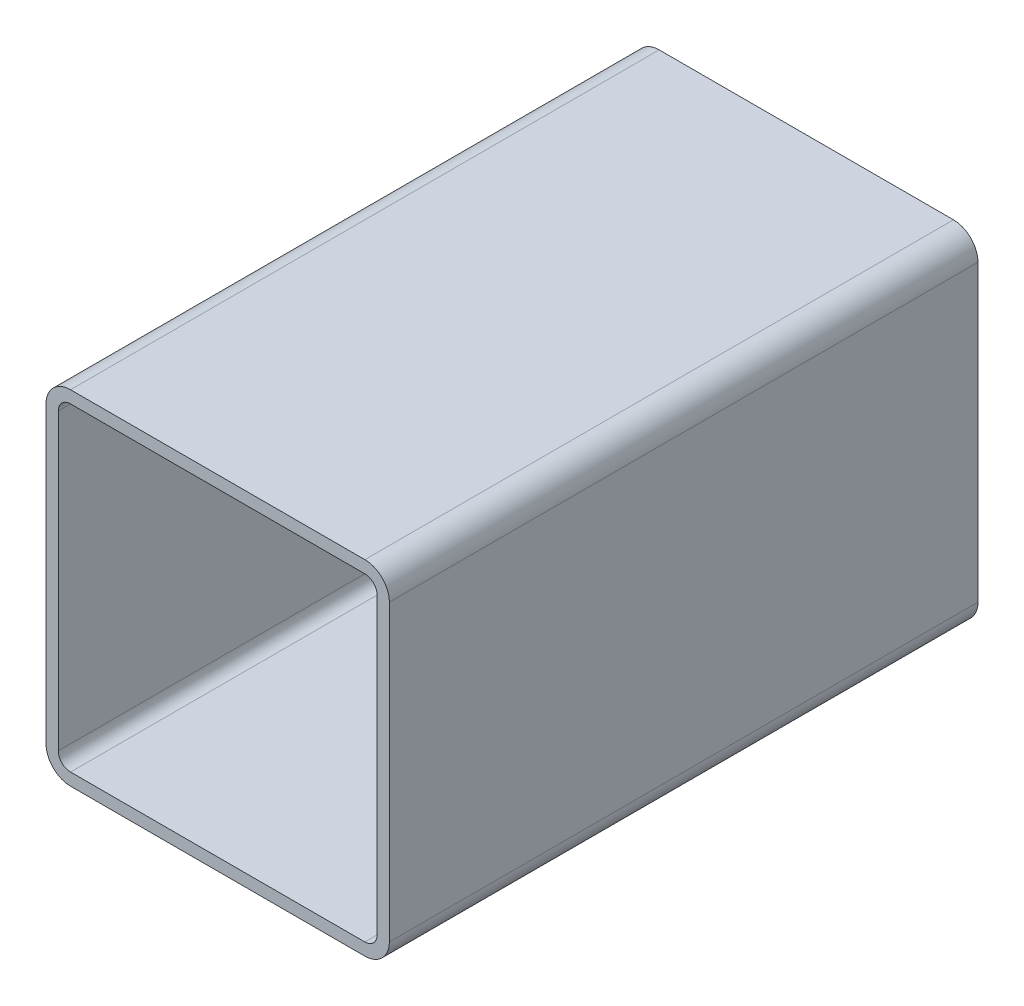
SolidWorks part; units mm, degrees
ref_plane "Front Plane" through (0, 0, 0) normal (0, 0, 1) x (1, 0, 0)
ref_plane "Top Plane" through (0, 0, 0) normal (0, 1, 0) x (1, 0, 0)
ref_plane "Right Plane" through (0, 0, 0) normal (1, 0, 0) x (0, 0, -1)
sketch "Sketch1" plane through (0, 0, 0) normal (0, 0, 1) x (1, 0, 0)
sketch_block_instance "HSS7x7x0.250-1"
sketch_block "HSS7x7x0.250"
extrude "Boss-Extrude1" add sketch "Sketch1" along normal blind 304.8
